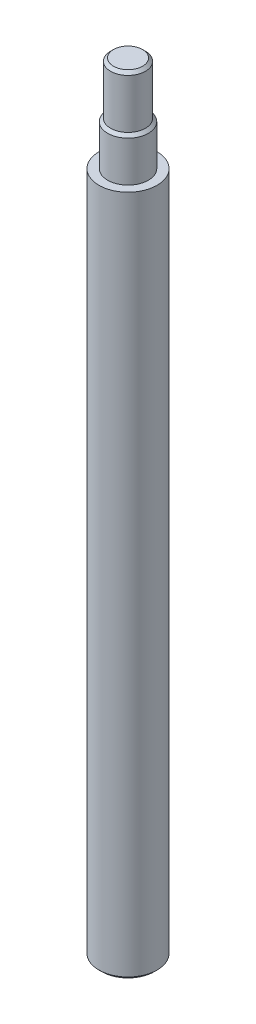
SolidWorks part; units mm, degrees
ref_plane "前视基准面" through (0, 0, 0) normal (0, 0, 1) x (1, 0, 0)
ref_plane "上视基准面" through (0, 0, 0) normal (0, 1, 0) x (1, 0, 0)
ref_plane "右视基准面" through (0, 0, 0) normal (1, 0, 0) x (0, 0, -1)
sketch "草图1" plane through (0, 0, 0) normal (0, 1, 0) x (1, 0, 0)
  circle A0 centre (0, 0) radius 10
extrude "凸台-拉伸1" add sketch "草图1" along normal blind 235
sketch "草图2" plane through (0, 235, 0) normal (0, 1, 0) x (1, 0, 0)
  circle A0 centre (0, 0) radius 7
extrude "凸台-拉伸2" add sketch "草图2" along normal blind 15
sketch "草图3" plane through (0, 250, 0) normal (0, 1, 0) x (1, 0, 0)
  circle A0 centre (0, 0) radius 6
extrude "凸台-拉伸3" add sketch "草图3" along normal blind 18
chamfer "倒角1" distance 1 angle 45 1 edges at (0, 0, 10)
chamfer "倒角2" distance 1 angle 45 1 edges at (0, 268, 6)
chamfer "倒角3" distance 1 angle 45 1 edges at (0, 250, 7)
